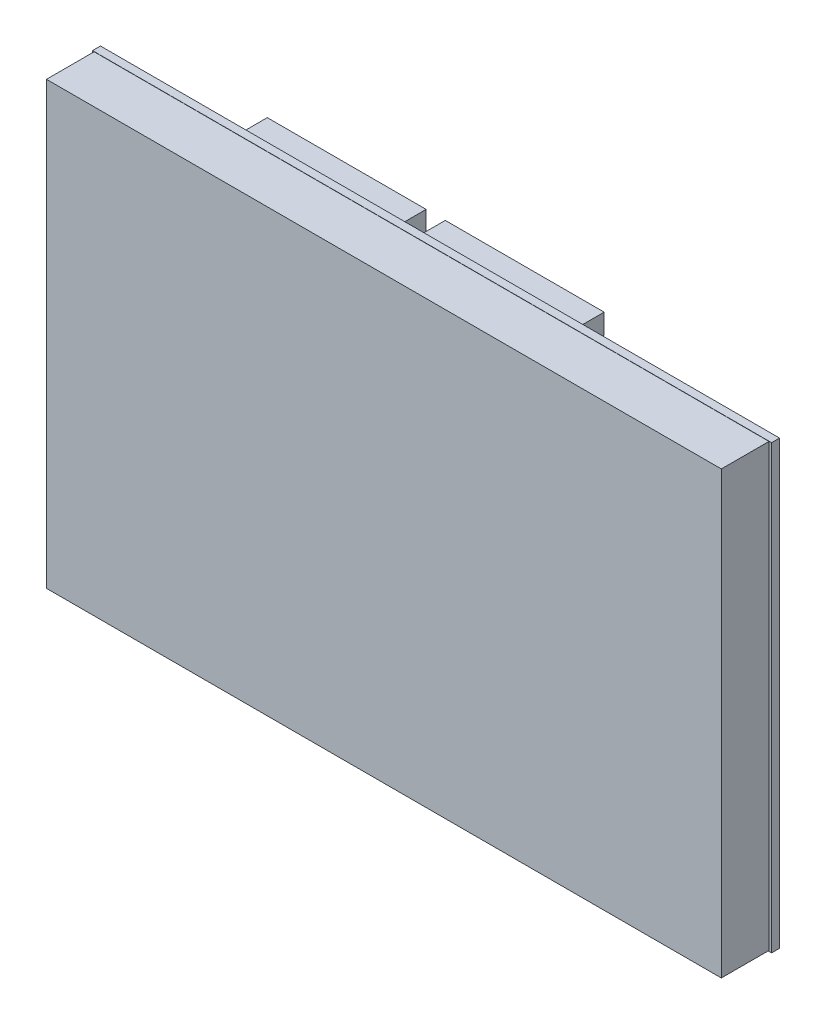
SolidWorks part; units mm, degrees
ref_plane "Ebene vorne" through (0, 0, 0) normal (0, 0, 1) x (1, 0, 0)
ref_plane "Ebene oben" through (0, 0, 0) normal (0, 1, 0) x (1, 0, 0)
ref_plane "Ebene rechts" through (0, 0, 0) normal (1, 0, 0) x (0, 0, -1)
sketch "Skizze1" plane through (0, 0, 0) normal (0, 0, 1) x (1, 0, 0)
  line L1 (42.745, -27.815) -> (-42.745, -27.815)
  line L2 (42.745, -27.815) -> (42.745, 27.815)
  line L3 (42.745, 27.815) -> (-42.745, 27.815)
  line L4 (-42.745, -27.815) -> (-42.745, 27.815)
  line L5 (42.745, -27.815) -> (-42.745, 27.815) construction
  line L6 (42.745, 27.815) -> (-42.745, -27.815) construction
  point P0 (0, 0)
  dimension "D1" = 55.63
  dimension "D2" = 85.49
extrude "Aufsatz-Linear austragen1" add sketch "Skizze1" against normal blind 1
sketch "Skizze2" plane through (0, 0, -1) normal (0, 0, -1) x (-1, 0, 0)
  line L0 (42.745, 27.815) -> (42.745, -27.815) construction
  line L1 (26.745, 25.505) -> (6.745, 25.505)
  line L2 (26.745, 25.505) -> (26.745, 23.005)
  line L3 (26.745, 23.005) -> (6.745, 23.005)
  line L4 (6.745, 25.505) -> (6.745, 23.005)
  line L5 (4.335, 25.505) -> (-15.665, 25.505)
  line L6 (4.335, 25.505) -> (4.335, 23.005)
  line L7 (4.335, 23.005) -> (-15.665, 23.005)
  line L8 (-15.665, 25.505) -> (-15.665, 23.005)
  line L10 (-42.745, 27.815) -> (42.745, 27.815) construction
  point P12 (-15.665, 24.255)
  dimension "D1" = 16
  dimension "D2" = 38.41
  dimension "D3" = 3.56
  dimension "D4" = 2.5
  dimension "D5" = 20
  dimension "D6" = 20
extrude "Aufsatz-Linear austragen2" add sketch "Skizze2" along normal blind 5 separate body
sketch "Skizze3" plane through (0, 0, -1) normal (0, 0, -1) x (-1, 0, 0)
  line L0 (42.745, 27.815) -> (42.745, -27.815) construction
  line L1 (41.745, -0.815) -> (26.745, -0.815)
  line L2 (41.745, -0.815) -> (41.745, -15.815)
  line L3 (41.745, -15.815) -> (26.745, -15.815)
  line L4 (26.745, -0.815) -> (26.745, -15.815)
  line L5 (42.745, -27.815) -> (-42.745, -27.815) construction
  dimension "D1" = 1
  dimension "D2" = 15
  dimension "D3" = 15
  dimension "D4" = 12
extrude "Aufsatz-Linear austragen3" add sketch "Skizze3" along normal blind 5 separate body
sketch "Skizze4" plane through (0, 0, -1) normal (0, 0, -1) x (-1, 0, 0)
  line L0 (42.745, 27.815) -> (42.745, -27.815) construction
  line L1 (17.745, -22.815) -> (1.745, -22.815)
  line L2 (17.745, -22.815) -> (17.745, -25.315)
  line L3 (17.745, -25.315) -> (1.745, -25.315)
  line L4 (1.745, -22.815) -> (1.745, -25.315)
  line L5 (0.245, -22.815) -> (-15.755, -22.815)
  line L6 (0.245, -22.815) -> (0.245, -25.315)
  line L7 (0.245, -25.315) -> (-15.755, -25.315)
  line L8 (-15.755, -22.815) -> (-15.755, -25.315)
  line L9 (42.745, -27.815) -> (-42.745, -27.815) construction
  point P10 (-15.755, -24.065)
  dimension "D1" = 25
  dimension "D2" = 16
  dimension "D3" = 42.5
  dimension "D4" = 16
  dimension "D5" = 3.75
  dimension "D6" = 2.5
extrude "Aufsatz-Linear austragen4" add sketch "Skizze4" along normal blind 5 separate body
sketch "Skizze5" plane through (0, 0, -1) normal (0, 0, -1) x (-1, 0, 0)
  line L0 (42.745, 27.815) -> (42.745, -27.815) construction
  line L1 (-27.745, 5.185) -> (-11.745, 5.185)
  line L2 (-27.745, 5.185) -> (-27.745, -2.815)
  line L3 (-27.745, -2.815) -> (-11.745, -2.815)
  line L4 (-11.745, 5.185) -> (-11.745, -2.815)
  line L5 (-12.745, -5.815) -> (-7.745, -5.815)
  line L6 (-12.745, -5.815) -> (-12.745, -7.815)
  line L7 (-12.745, -7.815) -> (-7.745, -7.815)
  line L8 (-7.745, -5.815) -> (-7.745, -7.815)
  line L9 (12.745, -10.815) -> (17.745, -10.815)
  line L10 (12.745, -10.815) -> (12.745, -15.815)
  line L11 (12.745, -15.815) -> (17.745, -15.815)
  line L12 (17.745, -10.815) -> (17.745, -15.815)
  line L13 (42.745, -27.815) -> (-42.745, -27.815) construction
  line L14 (-42.745, -27.815) -> (-42.745, 27.815) construction
  dimension "D1" = 25
  dimension "D2" = 5
  dimension "D3" = 5
  dimension "D4" = 12
  dimension "D5" = 25
  dimension "D6" = 8
  dimension "D7" = 15
  dimension "D8" = 16
  dimension "D9" = 30
  dimension "D10" = 5
  dimension "D11" = 2
  dimension "D12" = 20
extrude "Aufsatz-Linear austragen5" add sketch "Skizze5" along normal blind 2 separate body
sketch "Skizze6" plane through (0, 0, 0) normal (0, 0, 1) x (1, 0, 0)
  line L0 (-42.745, -27.815) -> (42.745, -27.815) construction
  line L1 (-42.545, 27.785) -> (42.415, 27.785)
  line L2 (-42.545, 27.785) -> (-42.545, -27.715)
  line L3 (-42.545, -27.715) -> (42.415, -27.715)
  line L4 (42.415, 27.785) -> (42.415, -27.715)
  line L5 (-42.745, 27.815) -> (-42.745, -27.815) construction
  dimension "D1" = 0.1
  dimension "D2" = 55.5
  dimension "D3" = 84.96
  dimension "D4" = 0.2
extrude "Aufsatz-Linear austragen6" add sketch "Skizze6" along normal blind 6 separate body
